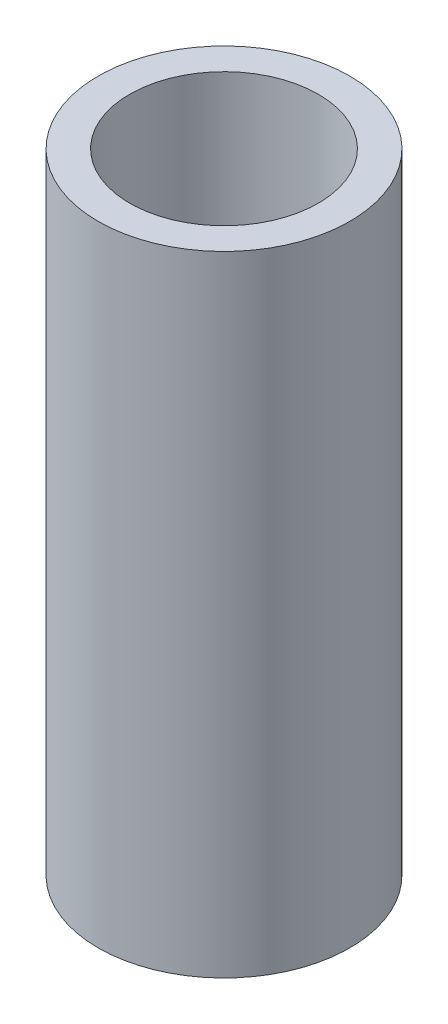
SolidWorks part; units mm, degrees
ref_plane "Front Plane" through (0, 0, 0) normal (0, 0, 1) x (1, 0, 0)
ref_plane "Top Plane" through (0, 0, 0) normal (0, 1, 0) x (1, 0, 0)
ref_plane "Right Plane" through (0, 0, 0) normal (1, 0, 0) x (0, 0, -1)
sketch "Sketch2" plane through (0, 0, 0) normal (0, 1, 0) x (1, 0, 0)
  circle A0 centre (0, 0) radius 25.4
  circle A1 centre (0, 0) radius 19.05
  dimension "D1" = 38.1
  dimension "D2" = 50.8
extrude "Boss-Extrude1" add sketch "Sketch2" along normal blind 406.4
sketch "Sketch3" plane through (0, 0, 0) normal (1, 0, 0) x (0, 0, -1)
  line L0 (25.4, 0) -> (25.4, 406.4) construction
  line L1 (-25.4, 406.4) -> (25.4, 406.4)
  line L2 (-25.4, 406.4) -> (-25.4, 127)
  line L3 (-25.4, 127) -> (25.4, 127)
  line L4 (25.4, 406.4) -> (25.4, 127)
  dimension "D1" = 279.4
extrude "Cut-Extrude1" cut sketch "Sketch3" against normal through all both and the other way through all
